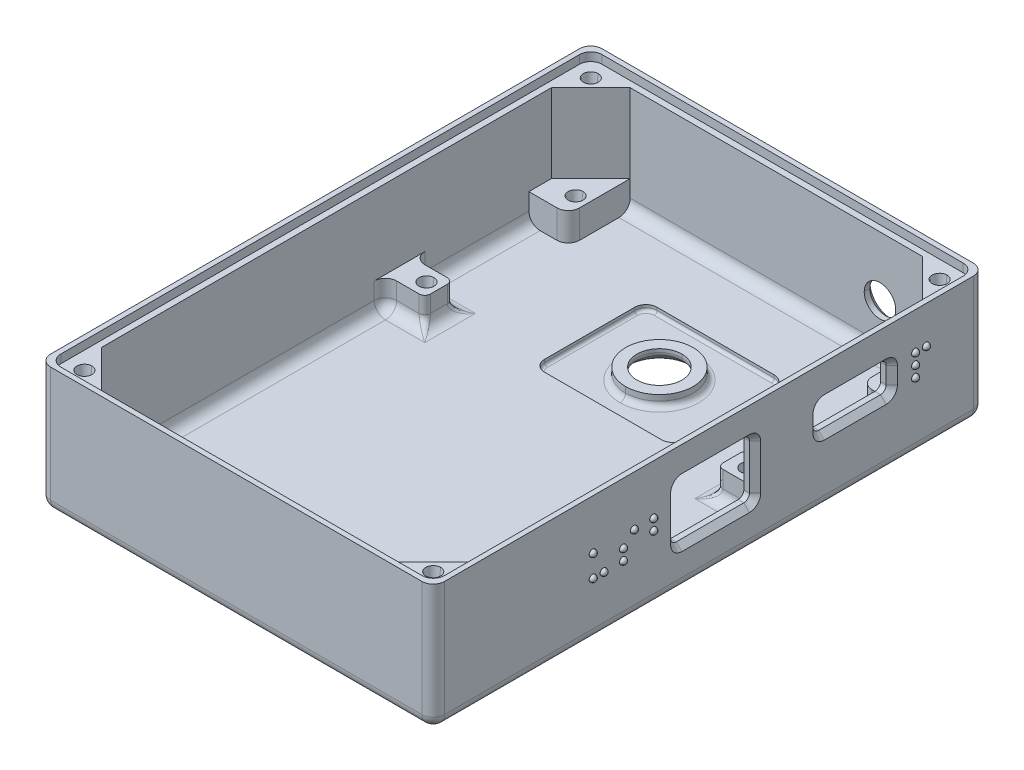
SolidWorks part; units mm, degrees
ref_plane "Front Plane" through (0, 0, 0) normal (0, 0, 1) x (1, 0, 0)
ref_plane "Top Plane" through (0, 0, 0) normal (0, 1, 0) x (1, 0, 0)
ref_plane "Right Plane" through (0, 0, 0) normal (1, 0, 0) x (0, 0, -1)
imported_body "Imported1"
sketch "Sketch1" plane through (88.9, 0, 0) normal (1, 0, 0) x (0, 0, -1)
  line L0 (75.4423, 2.4478) -> (75.4423, 27.4478)
  line L1 (75.4423, 27.4478) -> (-59.5577, 27.4478)
  line L2 (-59.5577, 27.4478) -> (-59.5577, 2.4478)
  line L3 (-59.5577, 2.4478) -> (75.4423, 2.4478)
  line L4 (12.6767, 8.9478) -> (12.6767, 20.9478)
  line L5 (12.6767, 20.9478) -> (30.6767, 20.9478)
  line L6 (30.6767, 20.9478) -> (30.6767, 8.9478)
  line L7 (30.6767, 8.9478) -> (12.6767, 8.9478)
  circle A0 centre (35.9423, 17.4478) radius 0.75
  circle A1 centre (35.9423, 12.5418) radius 0.75
  circle A2 centre (38.3953, 12.5418) radius 0.75
  circle A3 centre (42.7753, 12.5418) radius 0.75
  circle A4 centre (42.7753, 14.9948) radius 0.75
  circle A5 centre (45.2283, 17.4478) radius 0.75
  circle A6 centre (49.6083, 14.9948) radius 0.75
  circle A7 centre (49.6083, 17.4478) radius 0.75
sketch "Sketch2" plane through (88.9, 0, 0) normal (1, 0, 0) x (0, 0, -1)
  line L0 (53.698, 24.2968) -> (53.698, 11.2968)
  line L1 (53.698, 11.2968) -> (116.698, 11.2968)
  line L2 (116.698, 11.2968) -> (116.698, 24.2968)
  line L3 (116.698, 24.2968) -> (53.698, 24.2968)
  circle A0 centre (100.198, 17.7968) radius 3.25
  circle A1 centre (70.198, 17.7968) radius 3
  circle A2 centre (108.698, 20.2968) radius 0.75
  circle A3 centre (108.698, 17.8438) radius 0.75
  circle A4 centre (108.698, 15.3908) radius 0.75
  circle A5 centre (111.151, 20.2968) radius 0.75
extrude "Boss-Extrude1" add sketch "Sketch1" along normal blind 0.8 contours A0 | A1 | A6 | A7 | A5 | A3 | A4 | A2
extrude "Boss-Extrude2" add sketch "Sketch2" along normal blind 0.8 contours A2 | A3 | A5 | A4
fillet "Fillet1" radius 0.75 12 edges at (89.7, 14.9948, -50.3583) (89.7, 17.4478, -50.3583) (89.7, 17.4478, -45.9783) (89.7, 14.9948, -43.5253) (89.7, 12.5418, -43.5253) (89.7, 12.5418, -39.1453) (89.7, 12.5418, -36.6923) (89.7, 17.4478, -36.6923) (89.7, 20.2968, -111.901) (89.7, 15.3908, -109.448) (89.7, 17.8438, -109.448) (89.7, 20.2968, -109.448)
